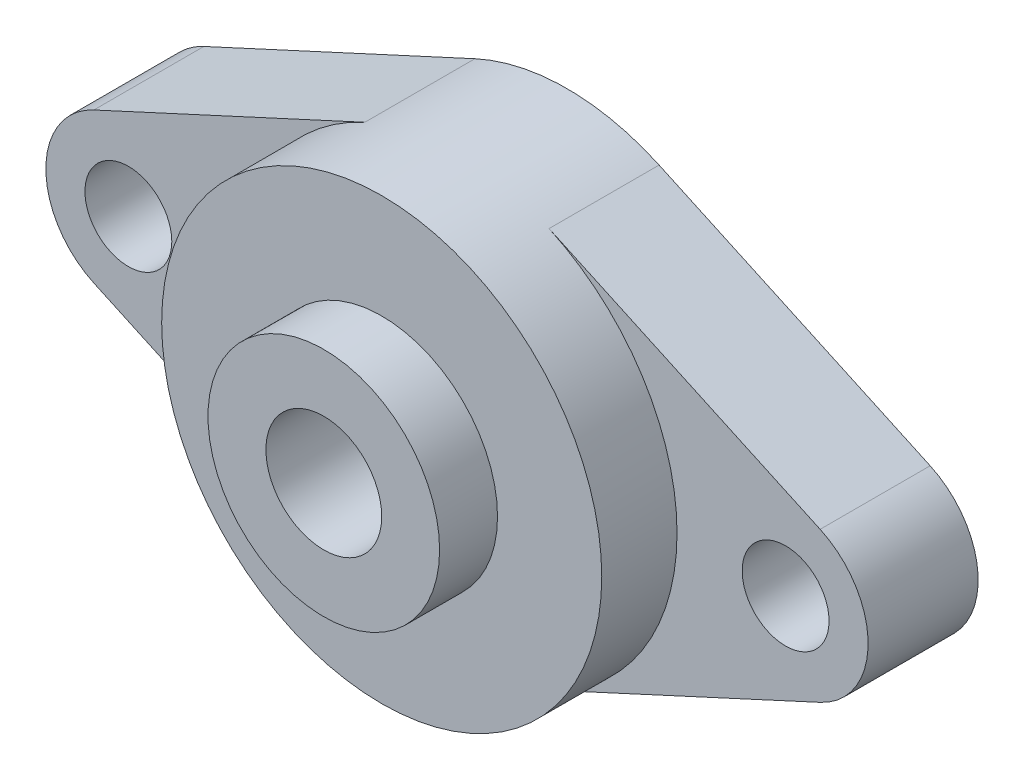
SolidWorks part; units mm, degrees
ref_plane "Front Plane" through (0, 0, 0) normal (0, 0, 1) x (1, 0, 0)
ref_plane "Top Plane" through (0, 0, 0) normal (0, 1, 0) x (1, 0, 0)
ref_plane "Right Plane" through (0, 0, 0) normal (1, 0, 0) x (0, 0, -1)
sketch "Sketch1" plane through (0, 0, 0) normal (0, 0, 1) x (1, 0, 0)
  line L1 (-49.779, 10.2728) -> (-12.6231, 27.3941)
  line L2 (-49.779, -10.2728) -> (-12.6231, -27.3941)
  line L3 (49.779, 10.2728) -> (12.6231, 27.3941)
  line L4 (12.6231, -27.3941) -> (49.779, -10.2728)
  circle A0 centre (0, 0) radius 30.1625
  arc A1 (-49.779, 10.2728) -> (-49.779, -10.2728) centre (-45.0453, 0) ccw
  arc A2 (49.779, -10.2728) -> (49.779, 10.2728) centre (45.0453, 0) ccw
  point P3 (-56.3562, 0)
  point P4 (56.3562, 0)
  dimension "D1" = 60.325
  dimension "D3" = 56.3562
  dimension "D2" = 56.3562
  dimension "D4" = 45.0453
  dimension "D5" = 45.0453
extrude "Boss-Extrude1" add sketch "Sketch1" against normal blind 15.0812 contours L1 A1 L2 A0 | L4 A2 L3 A0 | A0 A1
sketch "Sketch4" plane through (0, 0, 0) normal (0, 0, 1) x (1, 0, 0)
  circle A0 centre (0, 0) radius 30.1625
extrude "Boss-Extrude2" add sketch "Sketch4" along normal blind 10.3187
sketch "Sketch5" plane through (0, 0, 10.3187) normal (0, 0, 1) x (1, 0, 0)
  circle A0 centre (0, 0) radius 15.875
  dimension "D1" = 31.75
extrude "Boss-Extrude3" add sketch "Sketch5" along normal blind 7.9375
hole_wizard "5/8 (0.625) Diameter Hole1" positions "Sketch6" profile "Sketch7" hole size "5/8" standard "ANSI Inch"
sketch "Sketch6" plane through (0, 0, 18.2563) normal (0, 0, 1) x (1, 0, 0)
  point P0 (0, 0)
sketch "Sketch7" plane through (0, 0, 18.2563) normal (1, 0, 0) x (0, -1, 0)
  line L0 (0, 0) -> (0, 33.3375)
  line L1 (0, 33.3375) -> (7.9375, 33.3375)
  line L2 (7.9375, 33.3375) -> (7.9375, 0)
  line L5 (7.9375, 0) -> (0, 0)
  line L11 (0, -6.35) -> (0, 107.95) construction
  dimension "Thru Hole Dia." = 15.875
  dimension "Thru Hole Depth" = 33.3375
hole_wizard "15/32 (0.46875) Diameter Hole1" positions "Sketch8" profile "Sketch9" hole size "15/32" standard "ANSI Inch"
sketch "Sketch8" plane through (0, 0, 0) normal (0, 0, 1) x (1, 0, 0)
  point P0 (-45.0453, 0)
  point P2 (45.0453, 0)
  dimension "D1" = 90.0906
  dimension "D2" = 45.0453
sketch "Sketch9" plane through (-45.0453, 0, 0) normal (1, 0, 0) x (0, -1, 0)
  line L0 (0, 0) -> (0, 15.0812)
  line L1 (0, 15.0812) -> (5.9531, 15.0812)
  line L2 (5.9531, 15.0812) -> (5.9531, 0)
  line L5 (5.9531, 0) -> (0, 0)
  line L11 (0, -6.35) -> (0, 107.95) construction
  dimension "Thru Hole Dia." = 11.9062
  dimension "Thru Hole Depth" = 15.0812
